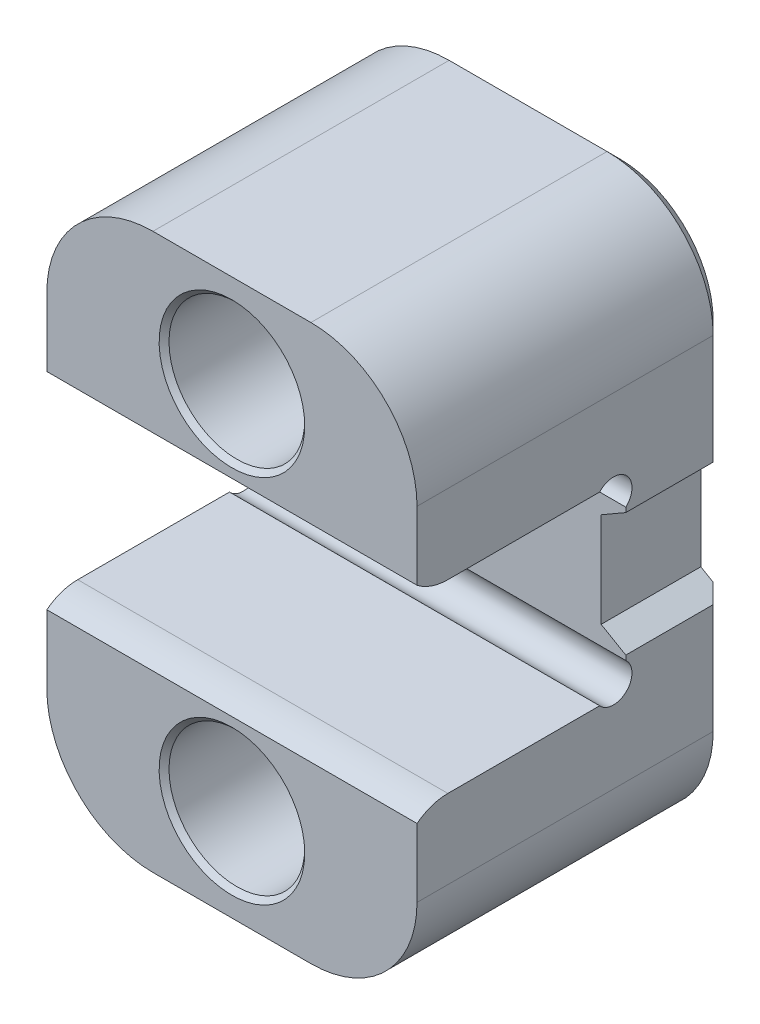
SolidWorks part; units mm, degrees
ref_plane "Front Plane" through (0, 0, 0) normal (0, 0, 1) x (1, 0, 0)
ref_plane "Top Plane" through (0, 0, 0) normal (0, 1, 0) x (1, 0, 0)
ref_plane "Right Plane" through (0, 0, 0) normal (1, 0, 0) x (0, 0, -1)
sketch "Sketch1" plane through (0, 0, 0) normal (1, 0, 0) x (0, 0, -1)
  line L0 (0, 0) -> (50000, 0) construction
  line L1 (0, 7.5) -> (16.92, 7.5)
  line L2 (0, 22.5) -> (25, 22.5)
  line L3 (0, 22.5) -> (0, 7.5)
  line L4 (0, -22.5) -> (25, -22.5)
  line L5 (25, 22.5) -> (25, -22.5)
  line L6 (16.92, 7.5) -> (16.92, -7.5)
  line L7 (16.92, -7.5) -> (0, -7.5)
  line L9 (0, 14.3) -> (0, -14.3) construction
  line L10 (0, -7.5) -> (0, -22.5)
  dimension "D1" = 25
  dimension "D2" = 45
  dimension "D3" = 16.92
  dimension "D4" = 15
extrude "Extrude1" add sketch "Sketch1" along normal mid plane 30
fillet "Fillet1" radius 8.6 4 edges at (-15, -22.5, -12.5) (-15, 22.5, -12.5) (15, -22.5, -12.5) (15, 22.5, -12.5)
sketch "Sketch2" plane through (-12, 0, 0) normal (0, 0, 1) x (1, 0, 0)
  line L0 (0, 0) -> (50000, 0) construction
  line L1 (27, 7.5) -> (27, -7.5) construction
  line L6 (25, -3.8453) -> (27, -5)
  line L10 (27, -5) -> (27, 5)
  line L11 (25, 3.8453) -> (27, 5)
  line L12 (25, -3.8453) -> (25, 3.8453)
  dimension "D1" = 2
  dimension "D2" = 10
  dimension "D3" = 30
extrude "Cut-Extrude1" cut sketch "Sketch2" against normal through all
sketch "Sketch5" plane through (15, 0, 0) normal (1, 0, 0) x (0, 0, -1)
  line L0 (0, 0) -> (50000, 0) construction
  line L1 (0, 7.5) -> (16.92, 7.5) construction
  line L2 (0, 13.9) -> (0, 7.5) construction
  line L3 (0, -7.5) -> (0, -13.9) construction
  line L4 (-7.5, -3.359) -> (2.5, -3.359)
  line L5 (-7.5, -3.359) -> (-7.5, -8.359)
  line L6 (-7.5, -8.359) -> (0, -8.359)
  line L7 (2.5, -3.359) -> (2.5, -7.5)
  line L8 (16.92, -7.5) -> (0, -7.5) construction
  line L9 (2.5, 3.359) -> (2.5, 7.5)
  line L10 (-7.5, 8.359) -> (0, 8.359)
  line L11 (-7.5, 3.359) -> (-7.5, 8.359)
  line L12 (-7.5, 3.359) -> (2.5, 3.359)
  arc A0 (0.3261, -7.8903) -> (2.5, -7.5) centre (2.5, -13.75) cw construction
  arc A1 (0, -8.359) -> (0.3261, -7.8903) centre (0.5, -8.359) cw construction
  arc A2 (0, 8.359) -> (0.3261, 7.8903) centre (0.5, 8.359) ccw construction
  arc A3 (0.3261, 7.8903) -> (2.5, 7.5) centre (2.5, 13.75) ccw construction
  arc A4 (0, 8.359) -> (2.5, 7.5) centre (2.5, 11.5673) ccw
  arc A5 (0, -8.359) -> (2.5, -7.5) centre (2.5, -11.5673) cw
  dimension "D1" = 0.5
  dimension "D2" = 6.25
  dimension "D3" = 5
  dimension "D4" = 10
  dimension "D5" = 2.5
extrude "Cut-Extrude2" cut sketch "Sketch5" against normal through all
sketch "Sketch6" plane through (15, 0, 0) normal (1, 0, 0) x (0, 0, -1)
  line L0 (0, 0) -> (50000, 0) construction
  line L3 (16.92, 7.5) -> (16.92, 5) construction
  line L4 (2.5, 7.5) -> (16.92, 7.5) construction
  circle A0 centre (15.92, 6.5) radius 1.5
  circle A1 centre (15.92, -6.5) radius 1.5
  dimension "D2" = 0.5
  dimension "D3" = 1.5
  dimension "D1" = 0.5
extrude "Cut-Extrude3" cut sketch "Sketch6" against normal through all
hole_wizard "CBORE for M6 SHCS1" positions "Sketch8" profile "Sketch7" counterbore size "M6" standard "Ansi Metric"
sketch "Sketch8" plane through (0, 0, 0) normal (0, 0, 1) x (1, 0, 0)
  line L0 (0, 0) -> (50000, 0) construction
  point P0 (0, 15)
  point P5 (0, -15)
  dimension "D1" = 30
sketch "Sketch7" plane through (0, 15, 0) normal (1, 0, 0) x (0, -1, 0)
  line L0 (0, 0) -> (0, 25)
  line L1 (0, 25) -> (3.5, 25)
  line L3 (3.5, 25) -> (3.5, 9)
  line L4 (3.5, 9) -> (5.5, 9)
  line L5 (5.5, 9) -> (5.5, 0)
  line L7 (5.5, 0) -> (0, 0)
  line L11 (0, -6.35) -> (0, 107.95) construction
  dimension "Thru Hole Dia." = 7
  dimension "Thru Hole Depth" = 25
  dimension "C'Bore Dia." = 11
  dimension "C'Bore Depth" = 9
chamfer "Chamfer1" distance 1 angle 45 9 edges at (-15, 0, -25) (-12.4811, -19.9811, -25) (0, -22.5, -25) (0, 22.5, -25) (-12.4811, 19.9811, -25) (12.4811, -19.9811, -25) (15, 9.45, -25) (15, -9.45, -25) (12.4811, 19.9811, -25)
chamfer "Chamfer3" distance 0.4 angle 45 2 edges at (5.5, -15, 0) (5.5, 15, 0)
